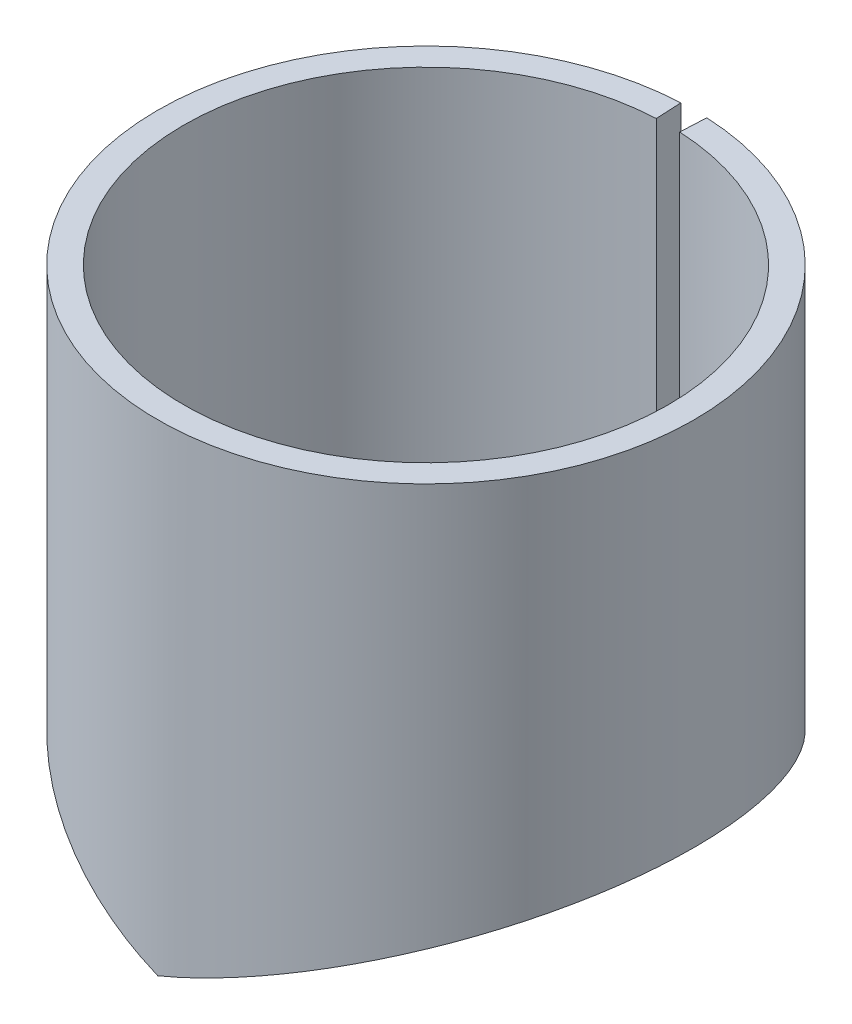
SolidWorks part; units mm, degrees
ref_plane "前视基准面" through (0, 0, 0) normal (0, 0, 1) x (1, 0, 0)
ref_plane "上视基准面" through (0, 0, 0) normal (0, 1, 0) x (1, 0, 0)
ref_plane "右视基准面" through (0, 0, 0) normal (1, 0, 0) x (0, 0, -1)
imported_body "基体零件-带补料的垂直四通管-1"
sheet metal parameters "钣金1" parameters "D1"=0.7366, "厚度"=1
bend "圆角折弯1" bend radius 9.3514 bend angle 354.463 parameters "D5"=1
flatten bends "展开-折弯1" parameters "D1"=0
sketch "尖角-草图1" plane through (0.5, 27.1237, -10.3393) normal (0.0483, 0, -0.9988) x (-0.9988, 0, -0.0483)
  line L0 (-28.9263, -9.1883) -> (-28.9263, 9.1883) construction
process bends "加工-折弯1" parameters "D1"=0
sketch "平面-草图1" plane through (0.5, 27.1237, -10.3393) normal (0.0483, 0, -0.9988) x (-0.9988, 0, -0.0483)
